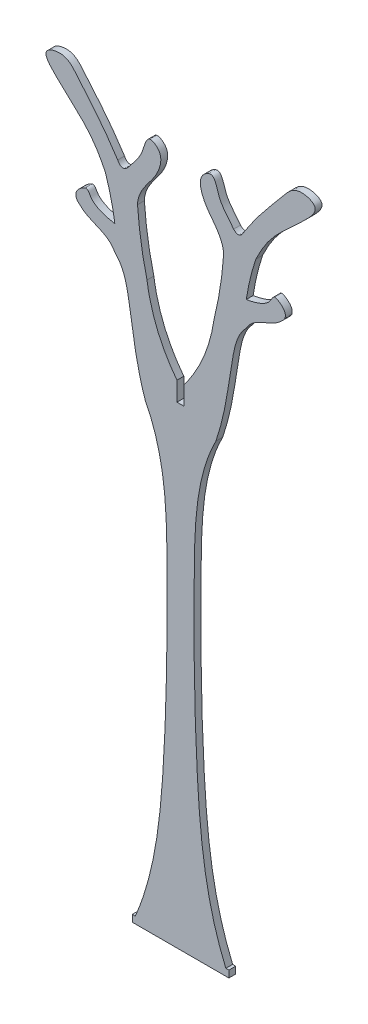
SolidWorks part; units mm, degrees
ref_plane "Piano frontale" through (0, 0, 0) normal (0, 0, 1) x (1, 0, 0)
ref_plane "Piano superiore" through (0, 0, 0) normal (0, 1, 0) x (1, 0, 0)
ref_plane "Piano destro" through (0, 0, 0) normal (1, 0, 0) x (0, 0, -1)
sketch "Schizzo2" plane through (0, 0, 0) normal (0, 0, 1) x (1, 0, 0)
  line L0 (-210.4392, 100.1935) -> (-9.7725, 100.1935) construction
  line L1 (-1393.8368, 755.4071) -> (-1393.8368, 705.4071)
  line L2 (-1393.8368, 705.4071) -> (-1374.8368, 705.4071)
  line L3 (-1511.2943, -537.4382) -> (-1257.3792, -537.4382)
  line L4 (-1511.2943, -537.4382) -> (-1511.2943, -519.4382)
  line L5 (-1511.2943, -519.4382) -> (-1503.2953, -519.4382)
  line L6 (-1374.8368, 755.4071) -> (-1374.8368, 705.4071)
  line L7 (-1257.3792, -519.4382) -> (-1257.3792, -537.4382)
  line L8 (-1265.3782, -519.4382) -> (-1257.3792, -519.4382)
  spline S0 degree 3 poles (-1477.2061, 667.9172) (-1422.859, 563.0356) (-1418.1339, 285.7933) (-1420.7818, -55.1586) (-1444.8644, -340.0197) (-1481.2163, -467.7203) (-1503.2953, -519.4382) knots 0 0 0 0 0.287218 0.658216 0.847461 0.984083 0.984083 0.984083 0.984083
  spline S1 degree 3 poles (-1477.2061, 667.9172) (-1489.8703, 705.017) (-1506.5746, 776.9339) (-1519.5188, 879.2996) (-1534.4074, 941.9938) (-1557.0535, 964.8227) knots 0 0 0 0 0.37926 0.713288 1 1 1 1
  spline S2 degree 3 poles (-1649.683, 1027.7181) (-1622.8758, 999.8061) (-1576.3118, 1001.6228) (-1557.0535, 964.8227) knots 0 0 0 0 1 1 1 1
  spline S3 degree 3 poles (-1649.683, 1027.7181) (-1668.7064, 1041.8311) (-1655.8606, 1063.2185) (-1628.5212, 1076.1468) (-1621.0569, 1057.6989) (-1599.5082, 1039.0875) (-1574.1539, 1033.0845) (-1557.0535, 1030.1525) knots 0 0 0 0 0.336795 0.409108 0.521188 0.643456 1 1 1 1
  spline S4 degree 2 poles (-1557.0535, 1030.1525) (-1564.889, 1083.4201) (-1582.0668, 1134.5322) knots 0 0 0 1 1 1
  spline S5 degree 3 poles (-1582.0668, 1134.5322) (-1619.2725, 1212.7712) (-1659.7337, 1234.0474) (-1757.3162, 1334.9657) (-1697.3322, 1351.9857) (-1669.8661, 1334.5172) (-1645.7156, 1303.5048) (-1602.4337, 1255.0223) (-1568.9218, 1208.5767) (-1549.6825, 1178.9276) knots 0 0 0 0 0.385763 0.485334 0.571207 0.624037 0.671733 0.795732 1 1 1 1
  spline S6 degree 2 poles (-1393.8368, 755.4071) (-1457.0821, 837.7538) (-1472.6193, 944.1521) knots 0 0 0 1 1 1
  spline S7 degree 2 poles (-1497.5369, 1103.1845) (-1491.9903, 1022.6772) (-1472.6193, 944.1521) knots 0 0 0 1 1 1
  spline S8 degree 3 poles (-1497.5369, 1103.1845) (-1497.1022, 1121.3632) (-1481.6827, 1153.2111) (-1453.5346, 1184.613) (-1440.9204, 1211.0214) (-1435.4934, 1231.5902) (-1436.247, 1255.5984) (-1471.5073, 1279.0347) (-1486.5438, 1215.3675) (-1502.1985, 1201.8062) (-1523.8775, 1173.8545) knots 0 0 0 0 0.17459 0.335889 0.411381 0.458068 0.543974 0.636309 0.747697 1 1 1 1
  spline S9 degree 2 poles (-1549.6825, 1178.9276) (-1538.8728, 1158.8648) (-1523.8775, 1173.8545) knots 0 0 0 1 1 1
  spline S10 degree 2 poles (-1218.991, 1178.9276) (-1229.8007, 1158.8648) (-1244.796, 1173.8545) knots 0 0 0 1 1 1
  spline S11 degree 3 poles (-1271.1367, 1103.1845) (-1271.5713, 1121.3632) (-1286.9909, 1153.2111) (-1315.139, 1184.613) (-1327.7531, 1211.0214) (-1333.1802, 1231.5902) (-1332.4265, 1255.5984) (-1297.1662, 1279.0347) (-1282.1297, 1215.3675) (-1266.4751, 1201.8062) (-1244.796, 1173.8545) knots 0 0 0 0 0.17459 0.335889 0.411381 0.458068 0.543974 0.636309 0.747697 1 1 1 1
  spline S12 degree 2 poles (-1271.1367, 1103.1845) (-1276.6832, 1022.6772) (-1296.0542, 944.1521) knots 0 0 0 1 1 1
  spline S13 degree 2 poles (-1374.8368, 755.4071) (-1311.5915, 837.7538) (-1296.0542, 944.1521) knots 0 0 0 1 1 1
  spline S14 degree 3 poles (-1186.6067, 1134.5322) (-1149.401, 1212.7712) (-1108.9398, 1234.0474) (-1011.3574, 1334.9657) (-1071.3414, 1351.9857) (-1098.8074, 1334.5172) (-1122.958, 1303.5048) (-1166.2399, 1255.0223) (-1199.7517, 1208.5767) (-1218.991, 1178.9276) knots 0 0 0 0 0.385763 0.485334 0.571207 0.624037 0.671733 0.795732 1 1 1 1
  spline S15 degree 2 poles (-1211.6201, 1030.1525) (-1203.7845, 1083.4201) (-1186.6067, 1134.5322) knots 0 0 0 1 1 1
  spline S16 degree 3 poles (-1118.9905, 1027.7181) (-1099.9672, 1041.8311) (-1112.813, 1063.2185) (-1140.1523, 1076.1468) (-1147.6167, 1057.6989) (-1169.1653, 1039.0875) (-1194.5197, 1033.0845) (-1211.6201, 1030.1525) knots 0 0 0 0 0.336795 0.409108 0.521188 0.643456 1 1 1 1
  spline S17 degree 3 poles (-1118.9905, 1027.7181) (-1145.7977, 999.8061) (-1192.3617, 1001.6228) (-1211.6201, 964.8227) knots 0 0 0 0 1 1 1 1
  spline S18 degree 3 poles (-1291.4674, 667.9172) (-1278.8033, 705.017) (-1262.0989, 776.9339) (-1249.1547, 879.2996) (-1234.2661, 941.9938) (-1211.6201, 964.8227) knots 0 0 0 0 0.37926 0.713288 1 1 1 1
  spline S19 degree 3 poles (-1291.4674, 667.9172) (-1345.8146, 563.0356) (-1350.5397, 285.7933) (-1347.8918, -55.1586) (-1323.8091, -340.0197) (-1287.4573, -467.7203) (-1265.3782, -519.4382) knots 0 0 0 0 0.287218 0.658216 0.847461 0.984083 0.984083 0.984083 0.984083
  point P31 (-1556.0917, 1178.7079)
  point P104 (-1384.3368, -537.4382)
  point P105 (-1212.5818, 1178.7079)
  dimension "D1" = 18
extrude "Estrusione-Estrusione1" add sketch "Schizzo2" along normal blind 18
